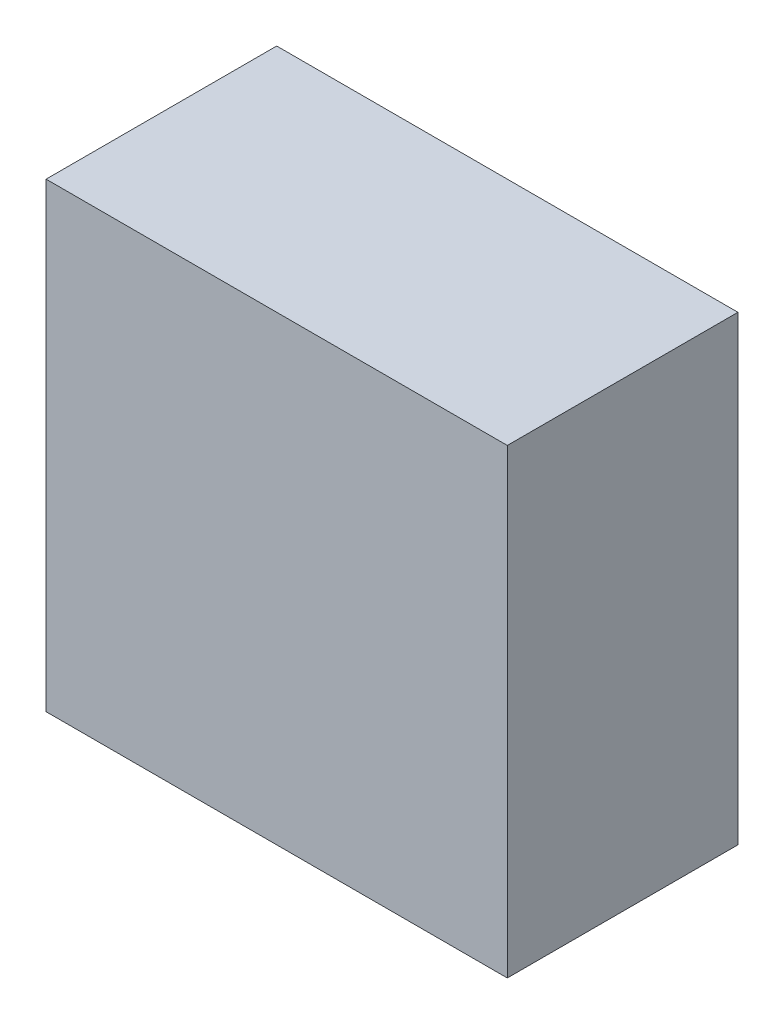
SolidWorks part; units mm, degrees
ref_plane "Face" through (0, 0, 0) normal (0, 0, 1) x (1, 0, 0)
ref_plane "Dessus" through (0, 0, 0) normal (0, 1, 0) x (1, 0, 0)
ref_plane "Droite" through (0, 0, 0) normal (1, 0, 0) x (0, 0, -1)
sketch "Esquisse1" plane through (0, 0, 0) normal (0, 0, 1) x (1, 0, 0)
  line L0 (1501.5558, -1200) -> (1501.5558, 0) construction
  line L1 (1501.5558, -225) -> (1451.5558, -225)
  line L2 (1501.5558, -225) -> (1501.5558, -175)
  line L3 (1501.5558, -175) -> (1451.5558, -175)
  line L4 (1451.5558, -225) -> (1451.5558, -175)
  line L5 (1451.5558, -1200) -> (1451.5558, 0) construction
  dimension "D1" = 50
extrude "Base-Extrusion" add sketch "Esquisse1" along normal blind 25
